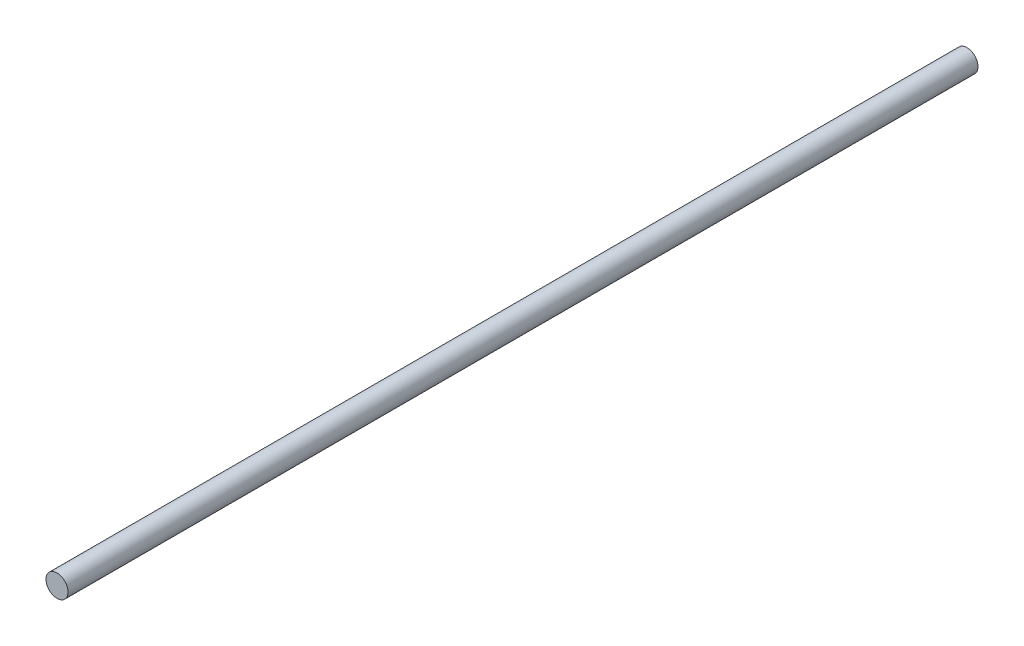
SolidWorks part; units mm, degrees
ref_plane "Front Plane" through (0, 0, 0) normal (0, 0, 1) x (1, 0, 0)
ref_plane "Top Plane" through (0, 0, 0) normal (0, 1, 0) x (1, 0, 0)
ref_plane "Right Plane" through (0, 0, 0) normal (1, 0, 0) x (0, 0, -1)
sketch "Sketch1" plane through (0, 0, 0) normal (0, 0, 1) x (1, 0, 0)
  circle A0 centre (-22.7704, -254.7822) radius 4
extrude "Boss-Extrude1" add sketch "Sketch1" along normal blind 330
